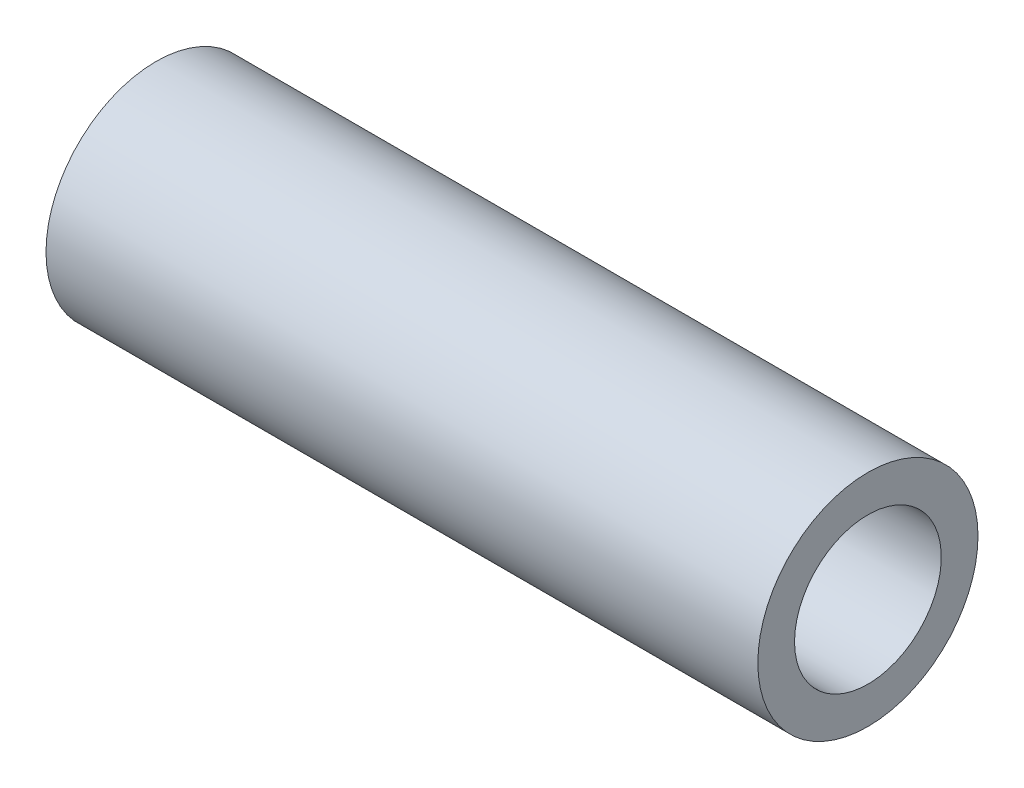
SolidWorks part; units mm, degrees
ref_plane "Piano frontale" through (0, 0, 0) normal (0, 0, 1) x (1, 0, 0)
ref_plane "Piano superiore" through (0, 0, 0) normal (0, 1, 0) x (1, 0, 0)
ref_plane "Piano destro" through (0, 0, 0) normal (1, 0, 0) x (0, 0, -1)
sketch "Schizzo1" plane through (0, 0, 0) normal (0, 0, 1) x (1, 0, 0)
  line L0 (-25.572, 0) -> (33.9161, 0) construction
  line L1 (-18.3802, 5) -> (-18.3802, 7.5)
  line L2 (-18.3802, 7.5) -> (30.1198, 7.5)
  line L3 (30.1198, 7.5) -> (30.1198, 5)
  line L4 (30.1198, 5) -> (-18.3802, 5)
  dimension "D1" = 7.5
  dimension "D2" = 48.5
  dimension "D3" = 5
revolve "Rivoluzione1" add sketch "Schizzo1" angle 360 about L0
